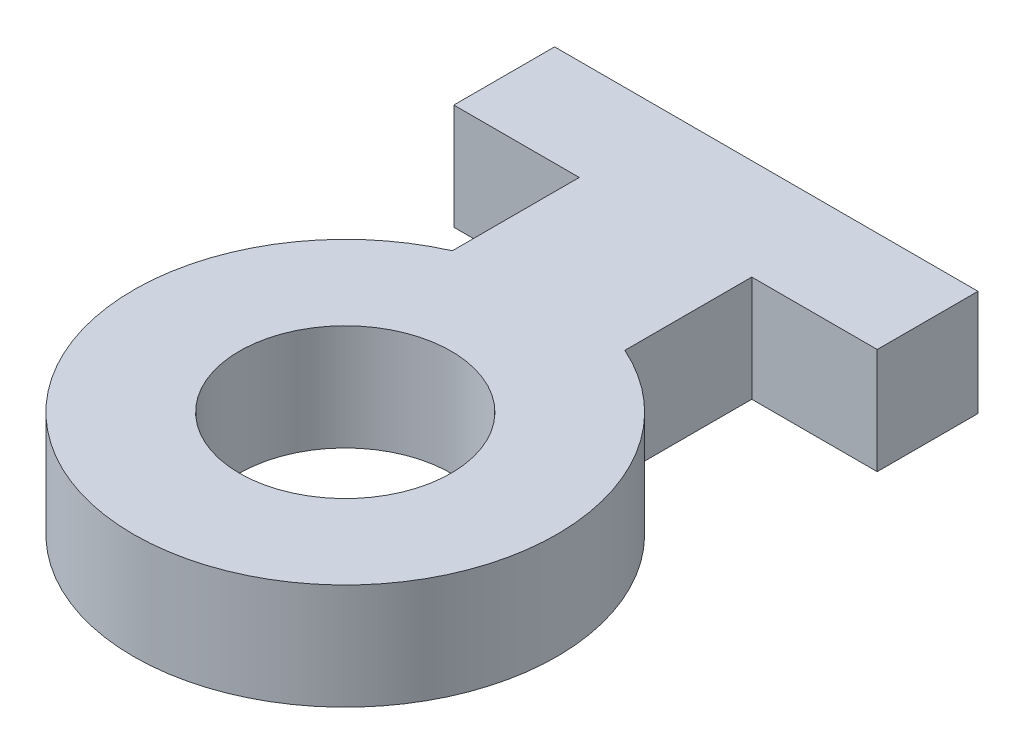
SolidWorks part; units mm, degrees
ref_plane "Front Plane" through (0, 0, 0) normal (0, 0, 1) x (1, 0, 0)
ref_plane "Top Plane" through (0, 0, 0) normal (0, 1, 0) x (1, 0, 0)
ref_plane "Right Plane" through (0, 0, 0) normal (1, 0, 0) x (0, 0, -1)
sketch "Sketch1" plane through (0, 0, 0) normal (0, 1, 0) x (1, 0, 0)
  line L0 (-2.5873, 9.6065) -> (-2.5873, 5.799)
  line L1 (2.5873, 9.6065) -> (6.35, 9.6065)
  line L4 (2.5873, 9.6065) -> (2.5873, 5.799)
  line L5 (-2.5873, 17.6033) -> (2.5873, 4.6328) construction
  line L6 (-2.5873, 4.6328) -> (2.5873, 17.6033) construction
  line L7 (-6.35, 12.6297) -> (6.35, 12.6297)
  line L8 (-6.35, 12.6297) -> (-6.35, 9.6065)
  line L9 (-6.35, 9.6065) -> (-2.5873, 9.6065)
  line L10 (6.35, 12.6297) -> (6.35, 9.6065)
  line L11 (-6.35, 12.6297) -> (6.35, 9.6065) construction
  line L12 (-6.35, 9.6065) -> (6.35, 12.6297) construction
  circle A0 centre (0, 0) radius 3.175
  arc A1 (-2.5873, 5.799) -> (2.5873, 5.799) centre (0, 0) ccw
  point P4 (0, 11.1181)
  point P9 (0, 11.1181)
extrude "Boss-Extrude1" add sketch "Sketch1" along normal blind 3.175
